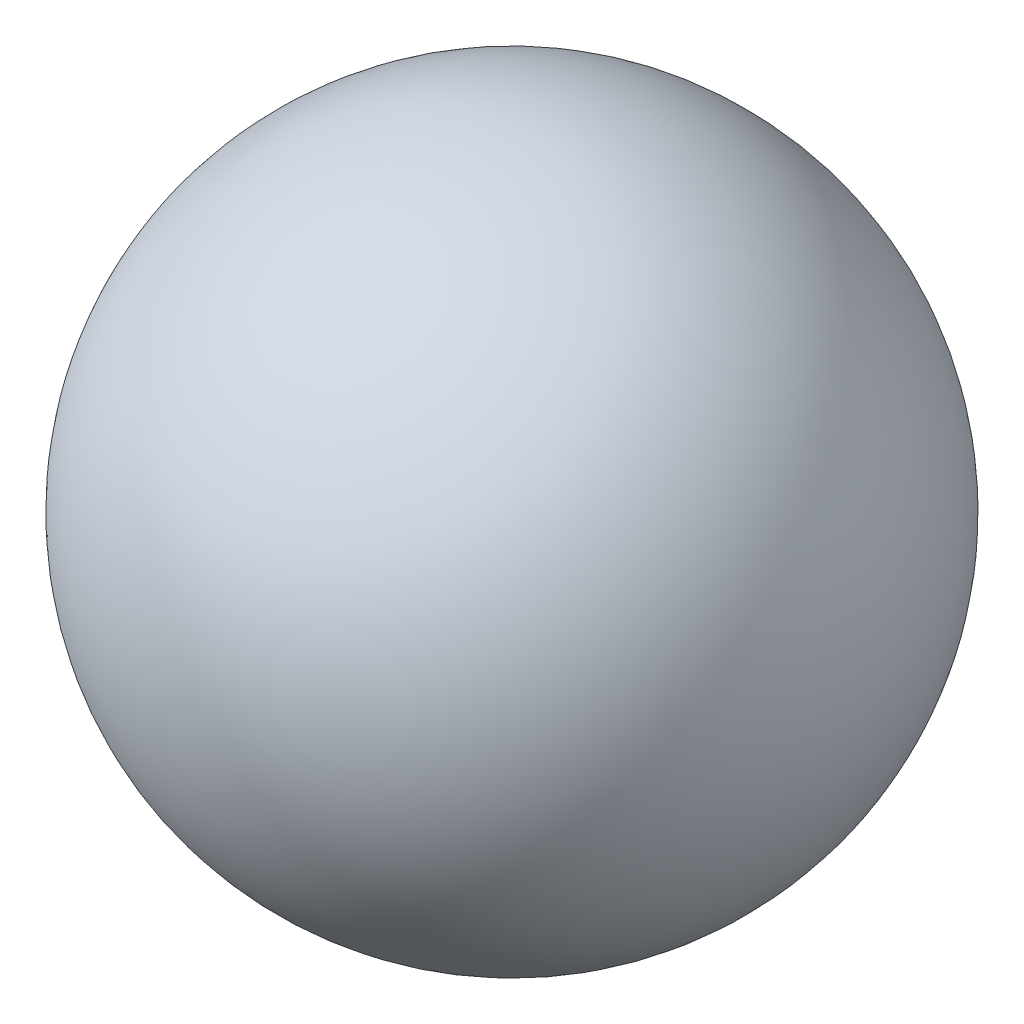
SolidWorks part; units mm, degrees
ref_plane "Front" through (0, 0, 0) normal (0, 0, 1) x (1, 0, 0)
ref_plane "Top" through (0, 0, 0) normal (0, 1, 0) x (1, 0, 0)
ref_plane "Right" through (0, 0, 0) normal (1, 0, 0) x (0, 0, -1)
sketch "草图1" plane through (0, 0, 0) normal (0, 0, 1) x (1, 0, 0)
  line L0 (-8.5, 0) -> (8.5, 0)
  arc A0 (8.5, 0) -> (-8.5, 0) centre (0, 0) ccw
  dimension "D1" = 17
revolve "旋转1" add sketch "草图1" angle 360 about L0
